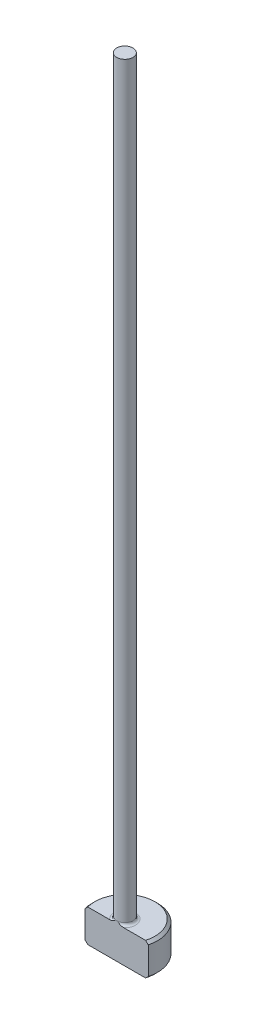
SolidWorks part; units mm, degrees
ref_plane "Front Plane" through (0, 0, 0) normal (0, 0, 1) x (1, 0, 0)
ref_plane "Top Plane" through (0, 0, 0) normal (0, 1, 0) x (1, 0, 0)
ref_plane "Right Plane" through (0, 0, 0) normal (1, 0, 0) x (0, 0, -1)
sketch "Sketch1" plane through (0, 0, 0) normal (0, 0, 1) x (1, 0, 0)
  line L0 (0, 259.9588) -> (0, -15.1925) construction
  line L1 (0, 0) -> (-3.175, 0)
  line L2 (-3.175, 0) -> (-3.175, 3.175)
  line L3 (-3.175, 3.175) -> (-0.7937, 3.175)
  line L4 (-0.7937, 3.175) -> (-0.7937, 76.2)
  line L5 (-0.7937, 76.2) -> (0, 76.2)
  line L6 (0, 76.2) -> (0, 0)
  dimension "L" = 76.2
  dimension "H" = 6.35
  dimension "T" = 3.175
  dimension "D" = 1.5875
revolve "Revolve1" add sketch "Sketch1" angle 360 about L0
chamfer "Chamfer1" distance 0.254 angle 45 2 edges at (0, 3.175, 3.175) (0, 0, 3.175)
fillet "Fillet1" radius 0.254 1 edges at (0, 3.175, 0.7937)
sketch "Sketch2" plane through (0, 0, 0) normal (0, 1, 0) x (1, 0, 0)
  line L0 (-3.0742, -0.7937) -> (3.0742, -0.7937)
  circle A0 centre (0, 0) radius 3.175 construction
  arc A1 (-3.0742, -0.7937) -> (3.0742, -0.7937) centre (0, 0) ccw
  circle A3 centre (0, 0) radius 0.7937 construction
  dimension "D1" = 0
extrude "Key" cut sketch "Sketch2" along normal through all
sketch "Pocket Sketch" plane through (0, 0, 0) normal (0, 0, 1) x (1, 0, 0)
  line L0 (-3.5719, 0) -> (-3.5719, 3.2004)
  line L1 (-3.5719, 3.2004) -> (-1.7542, 3.2004)
  line L2 (-0.9922, 3.9624) -> (-0.9922, 22.225)
  line L3 (-0.9922, 22.225) -> (0, 22.225)
  line L4 (0, 22.225) -> (0, 0)
  line L5 (0, 0) -> (-3.5719, 0)
  line L6 (0, 12.6104) -> (0, -2.4989) construction
  line L7 (-3.175, 2.921) -> (-3.175, 0.254) construction
  line L8 (2.921, 3.175) -> (-2.921, 3.175) construction
  line L9 (-0.7937, 76.2) -> (-0.7937, 3.429) construction
  line L10 (-1.7542, 3.2004) -> (-0.9922, 3.9624)
  point P3 (-0.9922, 3.2004)
  dimension "D1" = 7.1437
  dimension "D2" = 0.3969
  dimension "D3" = 0.0254
  dimension "D4" = 0.1984
  dimension "D5" = 1.9844
  dimension "D6" = 22.225
